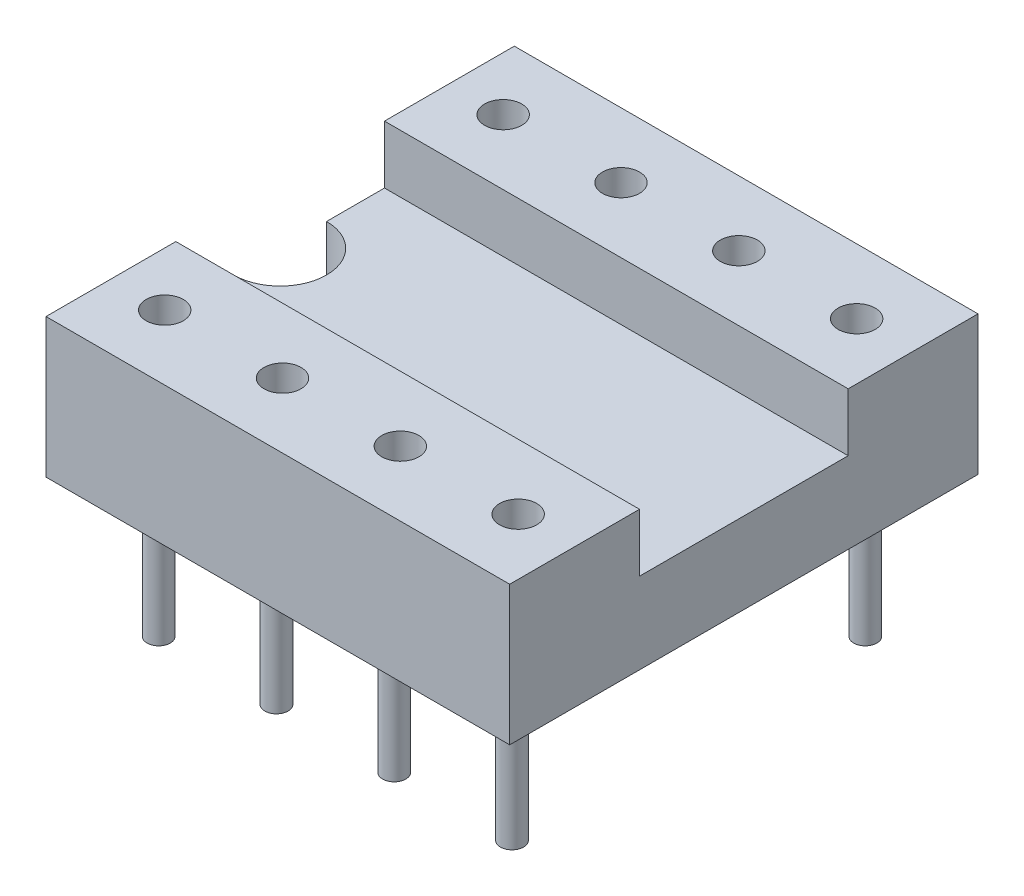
SolidWorks part; units mm, degrees
ref_plane "Plan de face" through (0, 0, 0) normal (0, 0, 1) x (1, 0, 0)
ref_plane "Plan de dessus" through (0, 0, 0) normal (0, 1, 0) x (1, 0, 0)
ref_plane "Plan de droite" through (0, 0, 0) normal (1, 0, 0) x (0, 0, -1)
sketch "Esquisse1" plane through (0, 0, 0) normal (1, 0, 0) x (0, 0, -1)
  line L0 (12.2051, 0) -> (-23.3437, 0) construction
  line L1 (0, -4.6214) -> (0, 25.9507) construction
  line L2 (-5.7968, 1.75) -> (2.763, 1.75) construction
  line L3 (5.7565, 3) -> (-6.8307, 3) construction
  line L4 (5.05, 3.8077) -> (5.05, -1.0493) construction
  line L5 (-5.05, 3.7235) -> (-5.05, -1.0493) construction
  line L6 (-2.25, 3.5071) -> (-2.25, 0.8142) construction
  line L7 (2.25, 3.5071) -> (2.25, 0.8142) construction
  line L8 (-2.25, 1.75) -> (-2.25, 3)
  line L9 (-2.25, 3) -> (-5.05, 3)
  line L10 (-5.05, 3) -> (-5.05, 0)
  line L11 (-5.05, 0) -> (5.05, 0)
  line L12 (5.05, 0) -> (5.05, 3)
  line L13 (5.05, 3) -> (2.25, 3)
  line L14 (2.25, 3) -> (2.25, 1.75)
  line L15 (2.25, 1.75) -> (-2.25, 1.75)
  dimension "D1" = 1.75
  dimension "D2" = 3
  dimension "D3" = 5.05
  dimension "D4" = 5.05
  dimension "D5" = 2.8
  dimension "D6" = 2.8
extrude "Extrusion1" add sketch "Esquisse1" along normal blind 10
sketch "Esquisse2" plane through (0, 1.75, 0) normal (0, 1, 0) x (-1, 0, 0)
  line L0 (0, -1) -> (0, 1)
  arc A0 (0, 1) -> (0, -1) centre (0, 0) ccw
extrude "Enlèv. mat.-Extru.1" cut sketch "Esquisse2" against normal through all
sketch "Esquisse3" plane through (0, 3, 0) normal (0, 1, 0) x (-1, 0, 0)
  line L0 (-13.1576, 5.05) -> (2.3638, 5.05) construction
  line L1 (0, 6.1465) -> (0, -6.3771) construction
  line L2 (1.5124, 0) -> (-12.9979, 0) construction
  line L3 (1.0512, 3.65) -> (-15.6055, 3.65) construction
  line L4 (-1.16, 6.2884) -> (-1.16, 1.7827) construction
  circle A0 centre (-1.16, 3.65) radius 0.4
  circle A1 centre (-1.16, -3.65) radius 0.4
  circle A2 centre (-3.701, 3.65) radius 0.4
  circle A3 centre (-3.701, -3.65) radius 0.4
  circle A4 centre (-6.242, 3.65) radius 0.4
  circle A5 centre (-6.242, -3.65) radius 0.4
  circle A6 centre (-8.783, 3.65) radius 0.4
  circle A7 centre (-8.783, -3.65) radius 0.4
  dimension "D1" = 1.4
  dimension "D2" = 1.16
extrude "Enlèv. mat.-Extru.2" cut sketch "Esquisse3" against normal blind 2.5
sketch "Esquisse5" plane through (0, 0, 0) normal (0, -1, 0) x (1, 0, 0)
  line L0 (-0.4263, 0) -> (10.6481, 0) construction
  line L1 (-1.4762, -3.81) -> (10.6481, -3.81) construction
  line L3 (8.81, -5.3786) -> (8.81, -0.4446) construction
  line L4 (10, -5.8991) -> (10, -1.6358) construction
  circle A0 centre (1.19, 3.81) radius 0.25
  circle A1 centre (1.19, -3.81) radius 0.25
  circle A2 centre (3.73, -3.81) radius 0.25
  circle A3 centre (3.73, 3.81) radius 0.25
  circle A4 centre (6.27, -3.81) radius 0.25
  circle A5 centre (6.27, 3.81) radius 0.25
  circle A6 centre (8.81, -3.81) radius 0.25
  circle A7 centre (8.81, 3.81) radius 0.25
  dimension "D1" = 3.81
  dimension "D2" = 1.19
extrude "Extrusion2" add sketch "Esquisse5" along normal blind 3
